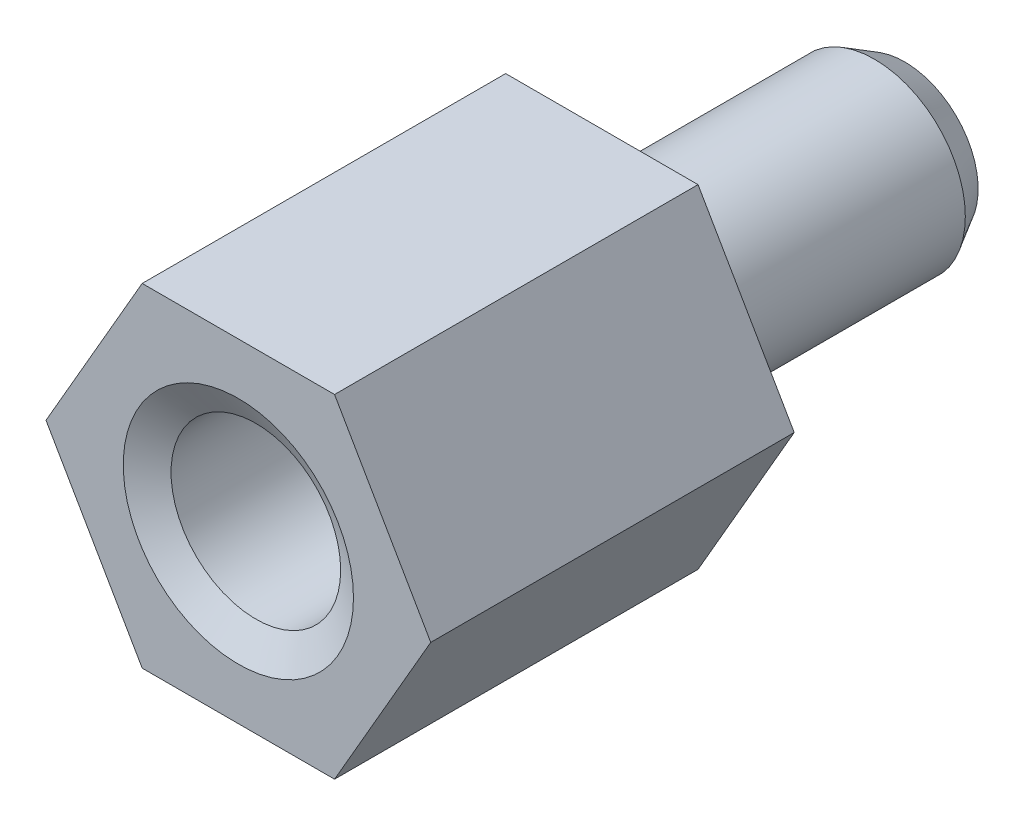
SolidWorks part; units mm, degrees
ref_plane "Front Plane" through (0, 0, 0) normal (0, 0, 1) x (1, 0, 0)
ref_plane "Top Plane" through (0, 0, 0) normal (0, 1, 0) x (1, 0, 0)
ref_plane "Right Plane" through (0, 0, 0) normal (1, 0, 0) x (0, 0, -1)
sketch "Sketch1" plane through (0, 0, 0) normal (0, 0, 1) x (1, 0, 0)
  line L1 (1.5877, 2.75) -> (-1.5877, 2.75)
  line L2 (-1.5877, 2.75) -> (-3.1754, 0)
  line L3 (-3.1754, 0) -> (-1.5877, -2.75)
  line L4 (-1.5877, -2.75) -> (1.5877, -2.75)
  line L5 (1.5877, -2.75) -> (3.1754, 0)
  line L6 (3.1754, 0) -> (1.5877, 2.75)
  circle A0 centre (0, 0) radius 2.75 construction
  dimension "D1" = 5.5
extrude "Boss-Extrude1" add sketch "Sketch1" along normal blind 6
sketch "Sketch2" plane through (0, 0, 0) normal (0, 0, -1) x (-1, 0, 0)
  circle A0 centre (0, 0) radius 1.5
  dimension "D1" = 3
extrude "Boss-Extrude2" add sketch "Sketch2" along normal blind 5
chamfer "Chamfer1" distance 0.5 angle 30 1 edges at (-1.5, 0, -5)
sketch "Sketch3" plane through (0, 0, 6) normal (0, 0, 1) x (1, 0, 0)
  circle A0 centre (0, 0) radius 1.4
  dimension "D1" = 2.8
extrude "Cut-Extrude1" cut sketch "Sketch3" against normal blind 3.5
chamfer "Chamfer2" distance 1.2 angle 30 1 edges at (1.4, 0, 2.5)
chamfer "Chamfer3" distance 0.5 angle 30 1 edges at (1.4, 0, 6)
